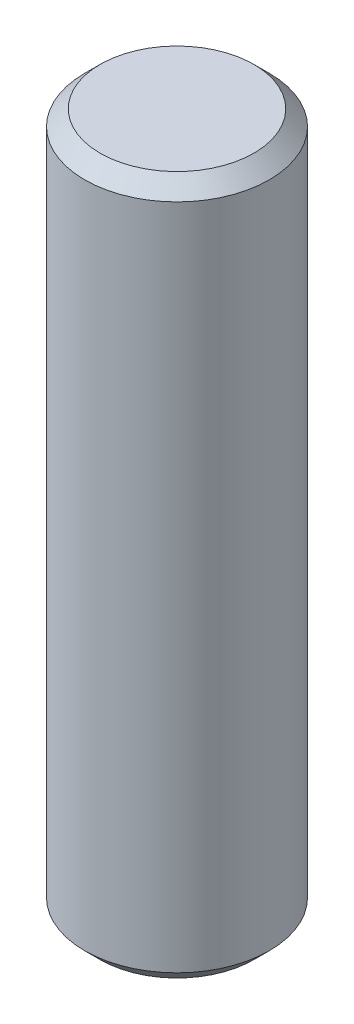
SolidWorks part; units mm, degrees
ref_plane "正面" through (0, 0, 0) normal (0, 0, 1) x (1, 0, 0)
ref_plane "平面" through (0, 0, 0) normal (0, 1, 0) x (1, 0, 0)
ref_plane "右側面" through (0, 0, 0) normal (1, 0, 0) x (0, 0, -1)
sketch "ｽｹｯﾁ1" plane through (0, 0, 0) normal (0, 1, 0) x (1, 0, 0)
  circle A0 centre (0, 0) radius 3
  dimension "D1" = 6
extrude "ﾎﾞｽ - 押し出し1" add sketch "ｽｹｯﾁ1" along normal blind 22.7
chamfer "面取り1" distance 0.5 angle 45 1 edges at (0, 22.7, 3)
chamfer "面取り2" distance 0.5 angle 45 1 edges at (0, 0, 3)
